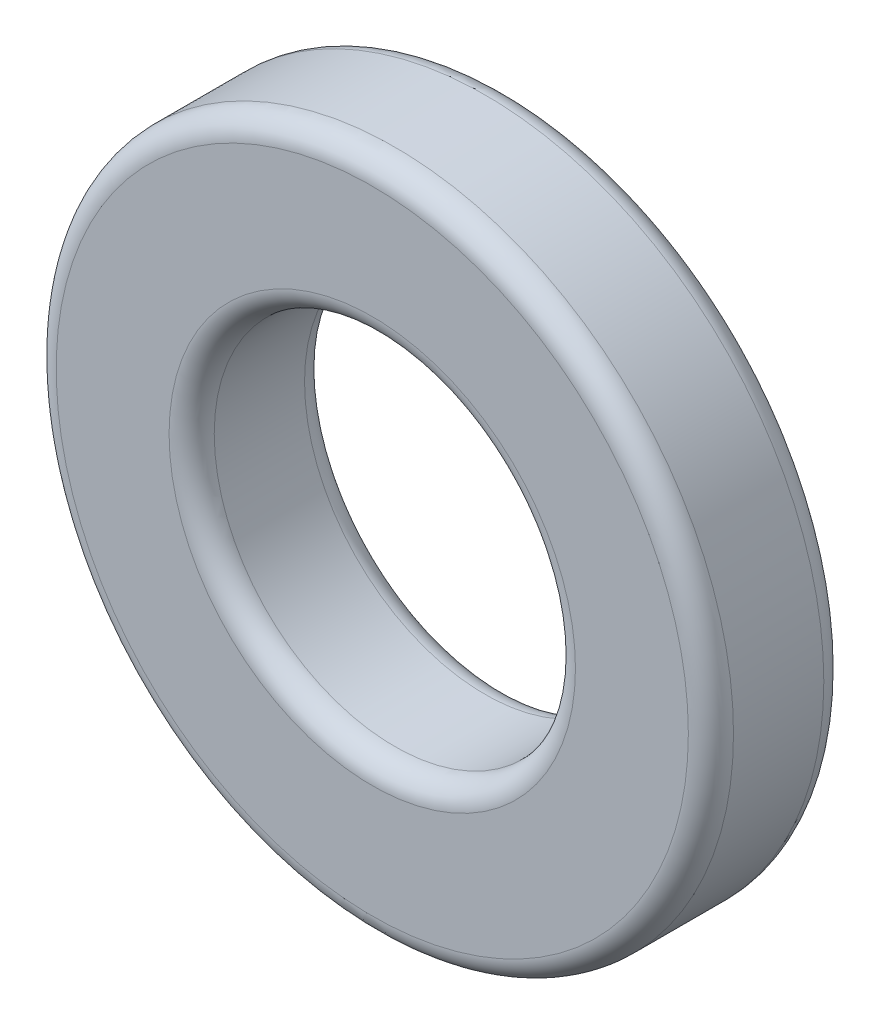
SolidWorks part; units mm, degrees
ref_plane "Спереди" through (0, 0, 0) normal (0, 0, 1) x (1, 0, 0)
ref_plane "Сверху" through (0, 0, 0) normal (0, 1, 0) x (1, 0, 0)
ref_plane "Справа" through (0, 0, 0) normal (1, 0, 0) x (0, 0, -1)
sketch "Эскиз1" plane through (0, 0, 0) normal (0, 0, 1) x (1, 0, 0)
  circle A0 centre (0, 0) radius 7.5
  circle A1 centre (0, 0) radius 4
  dimension "D1" = 8
  dimension "D2" = 15
extrude "Бобышка-Вытянуть1" add sketch "Эскиз1" along normal blind 3
fillet "Скругление1" radius 0.5 4 edges at (4, 0, 0) (4, 0, 3) (7.5, 0, 0) (7.5, 0, 3)
